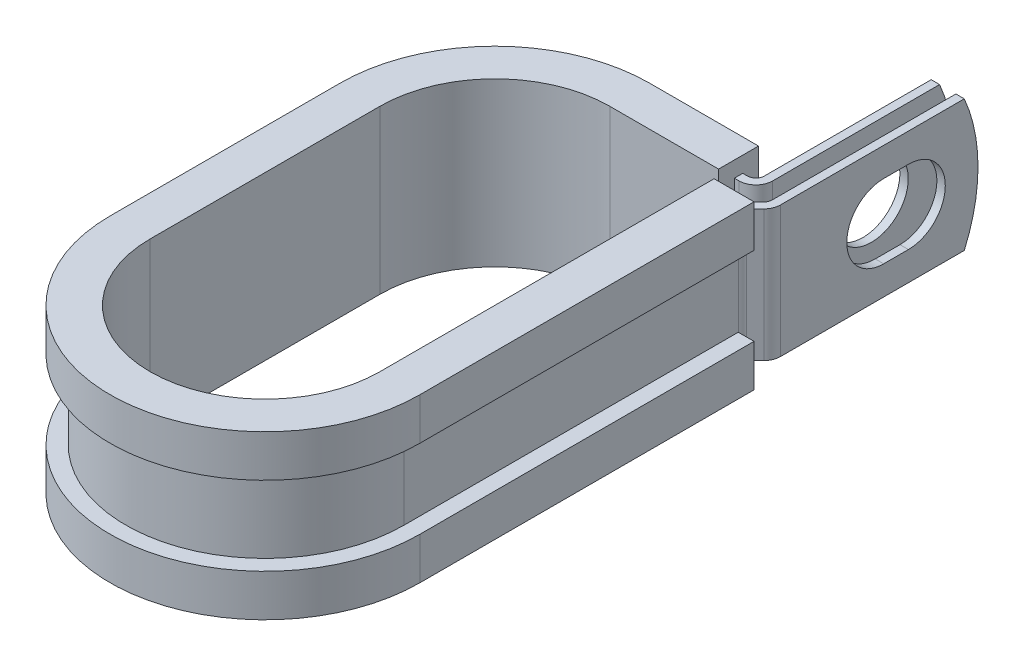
SolidWorks part; units mm, degrees
ref_plane "Front Plane" through (0, 0, 0) normal (0, 0, 1) x (1, 0, 0)
ref_plane "Top Plane" through (0, 0, 0) normal (0, 1, 0) x (1, 0, 0)
ref_plane "Right Plane" through (0, 0, 0) normal (1, 0, 0) x (0, 0, -1)
sketch "Sketch1" plane through (0, 0, 0) normal (0, 1, 0) x (1, 0, 0)
  line L0 (0, 12.6365) -> (10.9765, 12.6365)
  line L1 (12.6365, 0) -> (12.6365, 10.0861)
  line L2 (12.6021, 31.7246) -> (12.6021, 14.2621)
  line L3 (13.1126, 11.2356) -> (13.9388, 12.0618)
  line L4 (-12.6365, 0) -> (-12.6365, -22.225)
  line L5 (14.1769, 12.6365) -> (14.1769, 31.7246)
  line L6 (12.6365, 0) -> (12.6365, -22.225)
  arc A0 (0, 12.6365) -> (-12.6365, 0) centre (0, 0) ccw
  arc A1 (13.1126, 11.2356) -> (12.6365, 10.0861) centre (14.2621, 10.0861) ccw
  arc A2 (13.9388, 12.0618) -> (14.1769, 12.6365) centre (13.3641, 12.6365) ccw
  arc A3 (10.9765, 12.6365) -> (12.6021, 14.2621) centre (10.9765, 14.2621) ccw
  arc A4 (-12.6365, -22.225) -> (12.6365, -22.225) centre (0, -22.225) ccw
extrude "Extrude-Thin1" add sketch "Sketch1" along normal mid plane 12.7 thin
sketch "Sketch2" plane through (11.7893, 0, 0) normal (-1, 0, 0) x (0, 0, 1)
  line L0 (-31.7246, 6.35) -> (-31.7246, -6.35) construction
  line L1 (0, 6.35) -> (0, -6.35) construction
  circle A0 centre (-23.7998, 0) radius 3.5687
  point P2 (-31.7246, 0)
extrude "Cut-Extrude1" cut sketch "Sketch2" against normal up to surface (0.8128 mm away)
sketch "Sketch3" plane through (14.9897, 0, 0) normal (1, 0, 0) x (0, 0, -1)
  line L0 (22.606, 0) -> (24.9936, 0) construction
  line L1 (22.606, 3.5687) -> (24.9936, 3.5687)
  line L2 (22.606, -3.5687) -> (24.9936, -3.5687)
  line L3 (31.7246, 6.35) -> (31.7246, -6.35) construction
  arc A0 (22.606, 3.5687) -> (22.606, -3.5687) centre (22.606, 0) ccw
  arc A1 (24.9936, -3.5687) -> (24.9936, 3.5687) centre (24.9936, 0) ccw
  point P3 (23.7998, 0)
  point P8 (31.7246, 0)
  point P11 (19.0373, 0)
  point P12 (28.5623, 0)
extrude "Cut-Extrude2" cut sketch "Sketch3" against normal up to surface (0.8128 mm away)
sketch "Sketch4" plane through (11.7893, 0, 0) normal (-1, 0, 0) x (0, 0, 1)
  line L0 (-31.7246, 6.35) -> (-31.7246, -6.35)
  line L1 (-31.7246, 6.35) -> (-30.3993, 6.35)
  line L2 (-31.7246, 6.35) -> (-14.2621, 6.35) construction
  line L3 (-31.7246, -6.35) -> (-30.3993, -6.35)
  line L4 (-31.7246, -6.35) -> (-14.2621, -6.35) construction
  arc A0 (-30.3993, 6.35) -> (-30.3993, -6.35) centre (-15.8496, 0) ccw
extrude "Cut-Extrude3" cut sketch "Sketch4" against normal through all contours A0 M4 M5 | A0 L0 M2
ref_plane "Plane1" through (0, 0, -10.0861) normal (0, 0, -1) x (-1, 0, 0)
ref_plane "Plane2" through (10.5193, 0, 0) normal (-1, 0, 0) x (0, 0, 1)
sketch "Sketch5" plane through (0, 0, -10.0861) normal (0, 0, -1) x (-1, 0, 0)
  line L0 (-13.4493, 6.35) -> (-12.6365, 6.35)
  line L1 (-13.4493, 6.35) -> (-13.4493, -6.35) construction
  line L3 (-12.6365, 6.35) -> (-12.6365, -6.35)
  line L4 (-12.6365, -6.35) -> (-13.4493, -6.35)
  line L5 (-13.4493, -6.35) -> (-13.4493, -3.81)
  line L6 (-13.4493, 6.35) -> (-13.4493, 3.81)
  line L7 (-14.9733, 7.874) -> (-14.9733, 3.81)
  line L8 (-14.9733, 7.874) -> (-11.1125, 7.874)
  line L9 (-11.1125, 7.874) -> (-11.1125, -7.874)
  line L10 (-11.1125, -7.874) -> (-14.9733, -7.874)
  line L11 (-14.9733, -7.874) -> (-14.9733, -3.81)
  line L12 (-14.9733, 3.81) -> (-13.4493, 3.81)
  line L13 (-13.4493, -3.81) -> (-14.9733, -3.81)
sketch "Sketch6" plane through (0, 6.35, 0) normal (0, 1, 0) x (1, 0, 0)
  line L0 (11.1125, 0) -> (11.1125, 10.0861)
  line L1 (11.1125, 10.0861) -> (14.9733, 10.0861) construction
  line L2 (10.5193, 6.9878) -> (10.5193, -6.9878) construction
  line L3 (11.1125, -22.225) -> (11.1125, 0)
  line L4 (-11.1125, -22.225) -> (-11.1125, 0)
  line L5 (0, 11.1125) -> (10.5193, 11.1125)
  arc A0 (0, 11.1125) -> (-11.1125, 0) centre (0, 0) ccw
  arc A1 (-11.1125, -22.225) -> (11.1125, -22.225) centre (0, -22.225) ccw
sweep "Sweep1" add profiles "Sketch5" path "Sketch6"
equation "\"D4@Sketch5\" = \"D1@Extrude-Thin1\""
equation "\"D5@Sketch5\" = \"D5@Extrude-Thin1\""
equation "\"D1@Sketch3\" = \"D2@Sketch2\""
equation "\"D7@Sketch1\" = \"D3@Sketch2\" + \"D1@Sketch3\""
equation "\"D1@Sketch1\" = \"D1@Sketch6\" + 2 * \"D3@Sketch5\""
equation "\"D1@Sketch4\" = ( \"D1@Extrude-Thin1\" + .125 ) * 2"
equation "\"D9@Sketch1\"= \"D5@Extrude-Thin1\""
equation "\"D8@Sketch1\"= 2 * \"D5@Extrude-Thin1\""
equation "\"D2@Sketch1\" = 2 * \"D5@Extrude-Thin1\""
equation "\"D2@Sketch3\" = \"D1@Sketch2\""
equation "\"D6@Sketch1\" = \"D1@Sketch1\""
equation "\"D3@Sketch1\" = \"D1@Sketch6\""
